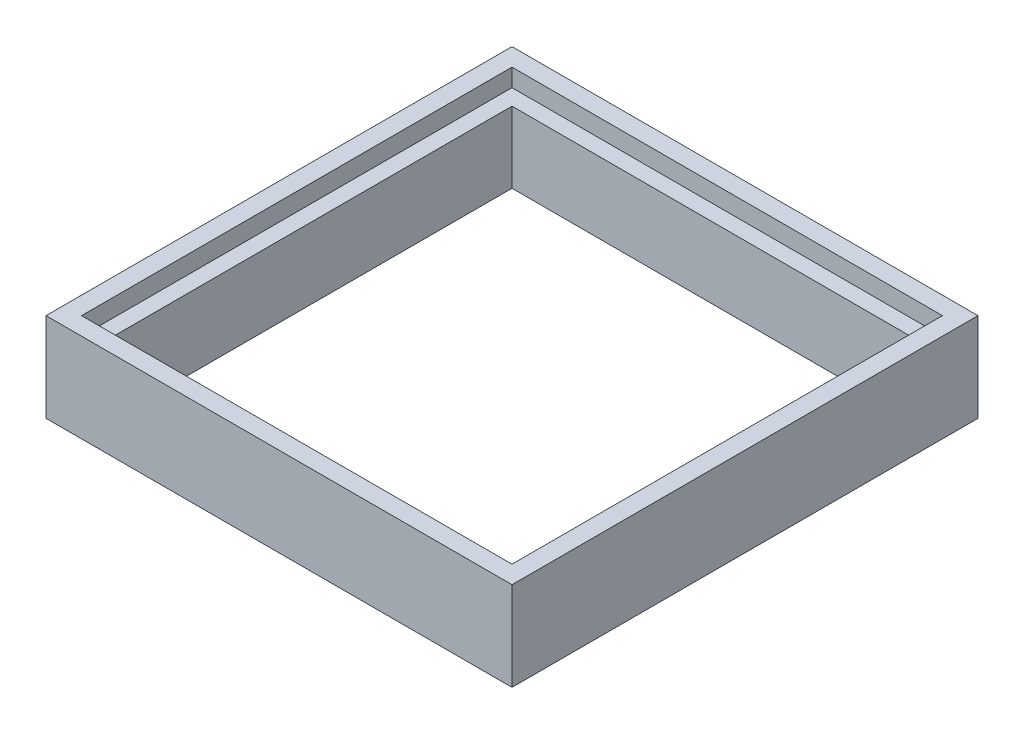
SolidWorks part; units mm, degrees
ref_plane "Front Plane" through (0, 0, 0) normal (0, 0, 1) x (1, 0, 0)
ref_plane "Top Plane" through (0, 0, 0) normal (0, 1, 0) x (1, 0, 0)
ref_plane "Right Plane" through (0, 0, 0) normal (1, 0, 0) x (0, 0, -1)
sketch "Sketch2" plane through (0, 0, 0) normal (0, 1, 0) x (1, 0, 0)
  line L5 (-16.375, 16.375) -> (16.375, 16.375)
  line L6 (-14, -14) -> (14, -14)
  line L14 (-14, -14) -> (-14, 14)
  line L15 (-14, 14) -> (14, 14)
  line L16 (14, -14) -> (14, 14)
  line L17 (-14, -14) -> (14, 14) construction
  line L18 (-14, 14) -> (14, -14) construction
  line L19 (16.375, -16.375) -> (16.375, 16.375)
  line L20 (-16.375, -16.375) -> (16.375, -16.375)
  line L21 (-16.375, -16.375) -> (-16.375, 16.375)
  point P0 (0, 0)
  dimension "D1" = 14
  dimension "D2" = 14
  dimension "D3" = 2.375
extrude "Boss-Extrude1" add sketch "Sketch2" along normal blind 6.25
sketch "Sketch3" plane through (0, 6.25, 0) normal (0, 1, 0) x (1, 0, 0)
  line L31 (15.125, 15.125) -> (-15.125, 15.125)
  line L32 (15.125, -15.125) -> (15.125, 15.125)
  line L33 (-15.125, -15.125) -> (15.125, -15.125)
  line L34 (-15.125, 15.125) -> (-15.125, -15.125)
  line L35 (15.125, 15.125) -> (-15.125, 15.125)
  line L36 (15.125, -15.125) -> (15.125, 15.125)
  line L37 (-15.125, -15.125) -> (15.125, -15.125)
  line L38 (-15.125, 15.125) -> (-15.125, -15.125)
  dimension "D1" = 1.25
extrude "Cut-Extrude1" cut sketch "Sketch3" against normal blind 1.25
